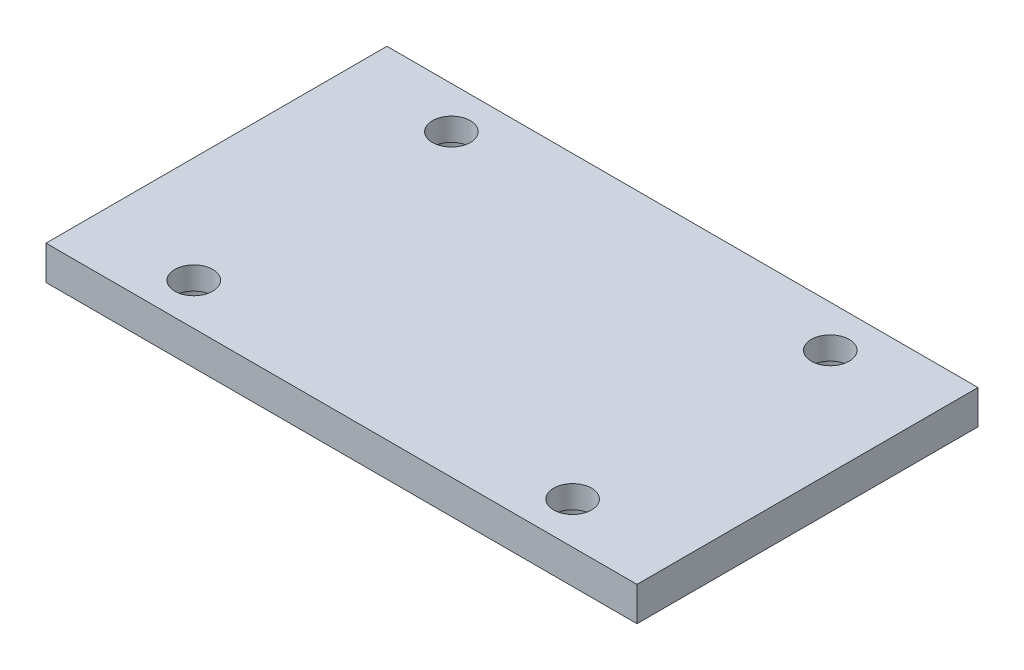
SolidWorks part; units mm, degrees
ref_plane "Plano frontal" through (0, 0, 0) normal (0, 0, 1) x (1, 0, 0)
ref_plane "Plano superior" through (0, 0, 0) normal (0, 1, 0) x (1, 0, 0)
ref_plane "Plano direito" through (0, 0, 0) normal (1, 0, 0) x (0, 0, -1)
sketch "Esboço1" plane through (0, 0, 0) normal (0, 1, 0) x (1, 0, 0)
  line L1 (-78, -45) -> (78, -45)
  line L2 (-78, -45) -> (-78, 45)
  line L3 (-78, 45) -> (78, 45)
  line L4 (78, -45) -> (78, 45)
  line L5 (-78, -45) -> (78, 45) construction
  line L6 (-78, 45) -> (78, -45) construction
  point P0 (0, 0)
  dimension "D1" = 156
  dimension "D2" = 90
extrude "Extrusão1" add sketch "Esboço1" along normal blind 9
sketch "Esboço2" plane through (0, 0, 0) normal (0, -1, 0) x (1, 0, 0)
  line L0 (78, 45) -> (78, -45) construction
  line L1 (-78, 45) -> (78, 45) construction
  circle A0 centre (50, 34) radius 5
  circle A1 centre (-50, 34) radius 5
  circle A2 centre (50, -34) radius 5
  circle A3 centre (-50, -34) radius 5
  dimension "D1" = 10
  dimension "D2" = 28
  dimension "D3" = 11
extrude "Extrusão2" cut sketch "Esboço2" against normal through all
sketch "Esboço4" plane through (0, 0, 0) normal (0, -1, 0) x (1, 0, 0)
  circle A0 centre (50, 34) radius 7.5
  circle A1 centre (-50, 34) radius 7.5
  circle A2 centre (50, -34) radius 7.5
  circle A3 centre (-50, -34) radius 7.5
  dimension "D1" = 15
extrude "Extrusão3" cut sketch "Esboço4" against normal blind 3
